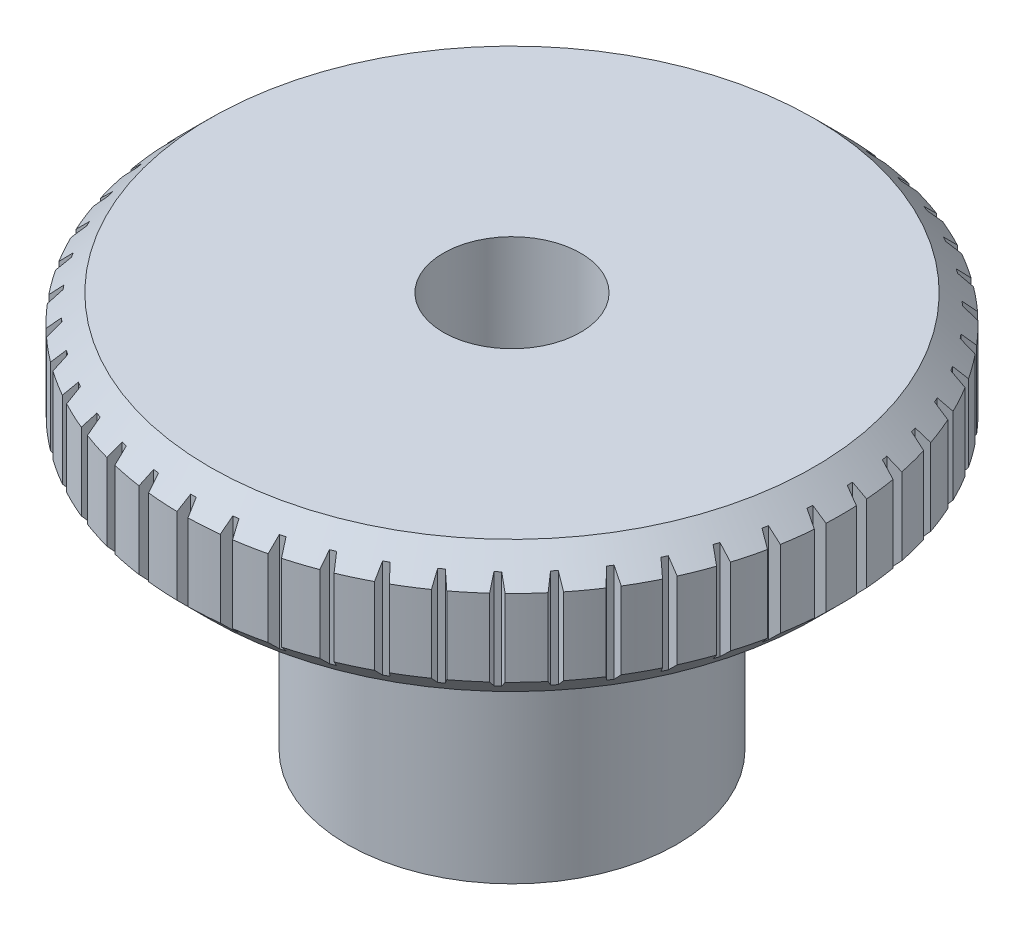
SolidWorks part; units mm, degrees
ref_plane "Спереди" through (0, 0, 0) normal (0, 0, 1) x (1, 0, 0)
ref_plane "Сверху" through (0, 0, 0) normal (0, 1, 0) x (1, 0, 0)
ref_plane "Справа" through (0, 0, 0) normal (1, 0, 0) x (0, 0, -1)
sketch "Эскиз1" plane through (0, 0, 0) normal (0, 0, 1) x (1, 0, 0)
  line L0 (0, 14.4034) -> (0, 0) construction
  line L1 (1.25, 0) -> (1.25, 7.2)
  line L2 (1.25, 7.2) -> (6, 7.2)
  line L3 (6, 7.2) -> (6, 4.8)
  line L4 (6, 4.8) -> (3, 4.8)
  line L5 (3, 4.8) -> (3, 0)
  line L6 (3, 0) -> (1.25, 0)
  dimension "D1" = 2.5
  dimension "D2" = 6
  dimension "D3" = 12
  dimension "D4" = 2.4
  dimension "D5" = 7.2
revolve "Повернуть1" add sketch "Эскиз1" angle 360 about L0
chamfer "Фаска1" distance 0.5 angle 45 2 edges at (0, 7.2, 6) (0, 4.8, 6)
sketch "Эскиз2" plane through (0, 7.2, 0) normal (0, 1, 0) x (1, 0, 0)
  line L0 (0, 9.4009) -> (0, 0) construction
  line L1 (0, 0) -> (11.0968, 0) construction
  line L2 (-0.1, 5.9992) -> (-0.05, 5.8)
  line L3 (-0.05, 5.8) -> (0.05, 5.8)
  line L4 (0.05, 5.8) -> (0.1, 5.9992)
  line L5 (0.7765, 5.748) -> (0.8511, 5.9393)
  line L6 (0.6527, 5.9644) -> (0.6773, 5.7605)
  line L7 (0.6773, 5.7605) -> (0.7765, 5.748)
  line L8 (1.4908, 5.6053) -> (1.5888, 5.7858)
  line L9 (1.3951, 5.8356) -> (1.394, 5.6302)
  line L10 (1.394, 5.6302) -> (1.4908, 5.6053)
  line L11 (2.1816, 5.3743) -> (2.3014, 5.5411)
  line L12 (2.1155, 5.6147) -> (2.0886, 5.4111)
  line L13 (2.0886, 5.4111) -> (2.1816, 5.3743)
  line L14 (2.838, 5.0585) -> (2.9778, 5.2089)
  line L15 (2.8025, 5.3053) -> (2.7504, 5.1067)
  line L16 (2.7504, 5.1067) -> (2.838, 5.0585)
  line L17 (3.4496, 4.6629) -> (3.6071, 4.7946)
  line L18 (3.4453, 4.9122) -> (3.3687, 4.7217)
  line L19 (3.3687, 4.7217) -> (3.4496, 4.6629)
  line L20 (4.0068, 4.1938) -> (4.1796, 4.3047)
  line L21 (4.0338, 4.4417) -> (3.9339, 4.2622)
  line L22 (3.9339, 4.2622) -> (4.0068, 4.1938)
  line L23 (4.5008, 3.6585) -> (4.6862, 3.747)
  line L24 (4.5587, 3.9011) -> (4.4371, 3.7356)
  line L25 (4.4371, 3.7356) -> (4.5008, 3.6585)
  line L26 (4.9239, 3.0656) -> (5.1188, 3.1301)
  line L27 (5.0117, 3.2989) -> (4.8703, 3.15)
  line L28 (4.8703, 3.15) -> (4.9239, 3.0656)
  line L29 (5.2693, 2.4243) -> (5.4708, 2.4638)
  line L30 (5.3856, 2.6448) -> (5.2267, 2.5148)
  line L31 (5.2267, 2.5148) -> (5.2693, 2.4243)
  line L32 (5.5316, 1.7447) -> (5.7364, 1.7587)
  line L33 (5.6746, 1.949) -> (5.5007, 1.8399)
  line L34 (5.5007, 1.8399) -> (5.5316, 1.7447)
  line L35 (5.7066, 1.0377) -> (5.9116, 1.0259)
  line L36 (5.8742, 1.2224) -> (5.6879, 1.1359)
  line L37 (5.6879, 1.1359) -> (5.7066, 1.0377)
  line L38 (5.7917, 0.3143) -> (5.9936, 0.2769)
  line L39 (5.981, 0.4765) -> (5.7854, 0.4141)
  line L40 (5.7854, 0.4141) -> (5.7917, 0.3143)
  line L41 (5.7854, -0.4141) -> (5.981, -0.4765)
  line L42 (5.9936, -0.2769) -> (5.7917, -0.3143)
  line L43 (5.7917, -0.3143) -> (5.7854, -0.4141)
  line L44 (5.6879, -1.1359) -> (5.8742, -1.2224)
  line L45 (5.9116, -1.0259) -> (5.7066, -1.0377)
  line L46 (5.7066, -1.0377) -> (5.6879, -1.1359)
  line L47 (5.5007, -1.8399) -> (5.6746, -1.949)
  line L48 (5.7364, -1.7587) -> (5.5316, -1.7447)
  line L49 (5.5316, -1.7447) -> (5.5007, -1.8399)
  line L50 (5.2267, -2.5148) -> (5.3856, -2.6448)
  line L51 (5.4708, -2.4638) -> (5.2693, -2.4243)
  line L52 (5.2693, -2.4243) -> (5.2267, -2.5148)
  line L53 (4.8703, -3.15) -> (5.0117, -3.2989)
  line L54 (5.1188, -3.1301) -> (4.9239, -3.0656)
  line L55 (4.9239, -3.0656) -> (4.8703, -3.15)
  line L56 (4.4371, -3.7356) -> (4.5587, -3.9011)
  line L57 (4.6862, -3.747) -> (4.5008, -3.6585)
  line L58 (4.5008, -3.6585) -> (4.4371, -3.7356)
  line L59 (3.9339, -4.2622) -> (4.0338, -4.4417)
  line L60 (4.1796, -4.3047) -> (4.0068, -4.1938)
  line L61 (4.0068, -4.1938) -> (3.9339, -4.2622)
  line L62 (3.3687, -4.7217) -> (3.4453, -4.9122)
  line L63 (3.6071, -4.7946) -> (3.4496, -4.6629)
  line L64 (3.4496, -4.6629) -> (3.3687, -4.7217)
  line L65 (2.7504, -5.1067) -> (2.8025, -5.3053)
  line L66 (2.9778, -5.2089) -> (2.838, -5.0585)
  line L67 (2.838, -5.0585) -> (2.7504, -5.1067)
  line L68 (2.0886, -5.4111) -> (2.1155, -5.6147)
  line L69 (2.3014, -5.5411) -> (2.1816, -5.3743)
  line L70 (2.1816, -5.3743) -> (2.0886, -5.4111)
  line L71 (1.394, -5.6302) -> (1.3951, -5.8356)
  line L72 (1.5888, -5.7858) -> (1.4908, -5.6053)
  line L73 (1.4908, -5.6053) -> (1.394, -5.6302)
  line L74 (0.6773, -5.7605) -> (0.6527, -5.9644)
  line L75 (0.8511, -5.9393) -> (0.7765, -5.748)
  line L76 (0.7765, -5.748) -> (0.6773, -5.7605)
  line L77 (-0.05, -5.8) -> (-0.1, -5.9992)
  line L78 (0.1, -5.9992) -> (0.05, -5.8)
  line L79 (0.05, -5.8) -> (-0.05, -5.8)
  line L80 (-0.7765, -5.748) -> (-0.8511, -5.9393)
  line L81 (-0.6527, -5.9644) -> (-0.6773, -5.7605)
  line L82 (-0.6773, -5.7605) -> (-0.7765, -5.748)
  line L83 (-1.4908, -5.6053) -> (-1.5888, -5.7858)
  line L84 (-1.3951, -5.8356) -> (-1.394, -5.6302)
  line L85 (-1.394, -5.6302) -> (-1.4908, -5.6053)
  line L86 (-2.1816, -5.3743) -> (-2.3014, -5.5411)
  line L87 (-2.1155, -5.6147) -> (-2.0886, -5.4111)
  line L88 (-2.0886, -5.4111) -> (-2.1816, -5.3743)
  line L89 (-2.838, -5.0585) -> (-2.9778, -5.2089)
  line L90 (-2.8025, -5.3053) -> (-2.7504, -5.1067)
  line L91 (-2.7504, -5.1067) -> (-2.838, -5.0585)
  line L92 (-3.4496, -4.6629) -> (-3.6071, -4.7946)
  line L93 (-3.4453, -4.9122) -> (-3.3687, -4.7217)
  line L94 (-3.3687, -4.7217) -> (-3.4496, -4.6629)
  line L95 (-4.0068, -4.1938) -> (-4.1796, -4.3047)
  line L96 (-4.0338, -4.4417) -> (-3.9339, -4.2622)
  line L97 (-3.9339, -4.2622) -> (-4.0068, -4.1938)
  line L98 (-4.5008, -3.6585) -> (-4.6862, -3.747)
  line L99 (-4.5587, -3.9011) -> (-4.4371, -3.7356)
  line L100 (-4.4371, -3.7356) -> (-4.5008, -3.6585)
  line L101 (-4.9239, -3.0656) -> (-5.1188, -3.1301)
  line L102 (-5.0117, -3.2989) -> (-4.8703, -3.15)
  line L103 (-4.8703, -3.15) -> (-4.9239, -3.0656)
  line L104 (-5.2693, -2.4243) -> (-5.4708, -2.4638)
  line L105 (-5.3856, -2.6448) -> (-5.2267, -2.5148)
  line L106 (-5.2267, -2.5148) -> (-5.2693, -2.4243)
  line L107 (-5.5316, -1.7447) -> (-5.7364, -1.7587)
  line L108 (-5.6746, -1.949) -> (-5.5007, -1.8399)
  line L109 (-5.5007, -1.8399) -> (-5.5316, -1.7447)
  line L110 (-5.7066, -1.0377) -> (-5.9116, -1.0259)
  line L111 (-5.8742, -1.2224) -> (-5.6879, -1.1359)
  line L112 (-5.6879, -1.1359) -> (-5.7066, -1.0377)
  line L113 (-5.7917, -0.3143) -> (-5.9936, -0.2769)
  line L114 (-5.981, -0.4765) -> (-5.7854, -0.4141)
  line L115 (-5.7854, -0.4141) -> (-5.7917, -0.3143)
  line L116 (-5.7854, 0.4141) -> (-5.981, 0.4765)
  line L117 (-5.9936, 0.2769) -> (-5.7917, 0.3143)
  line L118 (-5.7917, 0.3143) -> (-5.7854, 0.4141)
  line L119 (-5.6879, 1.1359) -> (-5.8742, 1.2224)
  line L120 (-5.9116, 1.0259) -> (-5.7066, 1.0377)
  line L121 (-5.7066, 1.0377) -> (-5.6879, 1.1359)
  line L122 (-5.5007, 1.8399) -> (-5.6746, 1.949)
  line L123 (-5.7364, 1.7587) -> (-5.5316, 1.7447)
  line L124 (-5.5316, 1.7447) -> (-5.5007, 1.8399)
  line L125 (-5.2267, 2.5148) -> (-5.3856, 2.6448)
  line L126 (-5.4708, 2.4638) -> (-5.2693, 2.4243)
  line L127 (-5.2693, 2.4243) -> (-5.2267, 2.5148)
  line L128 (-4.8703, 3.15) -> (-5.0117, 3.2989)
  line L129 (-5.1188, 3.1301) -> (-4.9239, 3.0656)
  line L130 (-4.9239, 3.0656) -> (-4.8703, 3.15)
  line L131 (-4.4371, 3.7356) -> (-4.5587, 3.9011)
  line L132 (-4.6862, 3.747) -> (-4.5008, 3.6585)
  line L133 (-4.5008, 3.6585) -> (-4.4371, 3.7356)
  line L134 (-3.9339, 4.2622) -> (-4.0338, 4.4417)
  line L135 (-4.1796, 4.3047) -> (-4.0068, 4.1938)
  line L136 (-4.0068, 4.1938) -> (-3.9339, 4.2622)
  line L137 (-3.3687, 4.7217) -> (-3.4453, 4.9122)
  line L138 (-3.6071, 4.7946) -> (-3.4496, 4.6629)
  line L139 (-3.4496, 4.6629) -> (-3.3687, 4.7217)
  line L140 (-2.7504, 5.1067) -> (-2.8025, 5.3053)
  line L141 (-2.9778, 5.2089) -> (-2.838, 5.0585)
  line L142 (-2.838, 5.0585) -> (-2.7504, 5.1067)
  line L143 (-2.0886, 5.4111) -> (-2.1155, 5.6147)
  line L144 (-2.3014, 5.5411) -> (-2.1816, 5.3743)
  line L145 (-2.1816, 5.3743) -> (-2.0886, 5.4111)
  line L146 (-1.394, 5.6302) -> (-1.3951, 5.8356)
  line L147 (-1.5888, 5.7858) -> (-1.4908, 5.6053)
  line L148 (-1.4908, 5.6053) -> (-1.394, 5.6302)
  line L149 (-0.6773, 5.7605) -> (-0.6527, 5.9644)
  line L150 (-0.8511, 5.9393) -> (-0.7765, 5.748)
  line L151 (-0.7765, 5.748) -> (-0.6773, 5.7605)
  circle A0 centre (0, 0) radius 6 construction
  arc A1 (0.1, 5.9992) -> (-0.1, 5.9992) centre (0, 0) ccw
  arc A2 (0.8511, 5.9393) -> (0.6527, 5.9644) centre (0, 0) ccw
  arc A3 (1.5888, 5.7858) -> (1.3951, 5.8356) centre (0, 0) ccw
  arc A4 (2.3014, 5.5411) -> (2.1155, 5.6147) centre (0, 0) ccw
  arc A5 (2.9778, 5.2089) -> (2.8025, 5.3053) centre (0, 0) ccw
  arc A6 (3.6071, 4.7946) -> (3.4453, 4.9122) centre (0, 0) ccw
  arc A7 (4.1796, 4.3047) -> (4.0338, 4.4417) centre (0, 0) ccw
  arc A8 (4.6862, 3.747) -> (4.5587, 3.9011) centre (0, 0) ccw
  arc A9 (5.1188, 3.1301) -> (5.0117, 3.2989) centre (0, 0) ccw
  arc A10 (5.4708, 2.4638) -> (5.3856, 2.6448) centre (0, 0) ccw
  arc A11 (5.7364, 1.7587) -> (5.6746, 1.949) centre (0, 0) ccw
  arc A12 (5.9116, 1.0259) -> (5.8742, 1.2224) centre (0, 0) ccw
  arc A13 (5.9936, 0.2769) -> (5.981, 0.4765) centre (0, 0) ccw
  arc A14 (5.981, -0.4765) -> (5.9936, -0.2769) centre (0, 0) ccw
  arc A15 (5.8742, -1.2224) -> (5.9116, -1.0259) centre (0, 0) ccw
  arc A16 (5.6746, -1.949) -> (5.7364, -1.7587) centre (0, 0) ccw
  arc A17 (5.3856, -2.6448) -> (5.4708, -2.4638) centre (0, 0) ccw
  arc A18 (5.0117, -3.2989) -> (5.1188, -3.1301) centre (0, 0) ccw
  arc A19 (4.5587, -3.9011) -> (4.6862, -3.747) centre (0, 0) ccw
  arc A20 (4.0338, -4.4417) -> (4.1796, -4.3047) centre (0, 0) ccw
  arc A21 (3.4453, -4.9122) -> (3.6071, -4.7946) centre (0, 0) ccw
  arc A22 (2.8025, -5.3053) -> (2.9778, -5.2089) centre (0, 0) ccw
  arc A23 (2.1155, -5.6147) -> (2.3014, -5.5411) centre (0, 0) ccw
  arc A24 (1.3951, -5.8356) -> (1.5888, -5.7858) centre (0, 0) ccw
  arc A25 (0.6527, -5.9644) -> (0.8511, -5.9393) centre (0, 0) ccw
  arc A26 (-0.1, -5.9992) -> (0.1, -5.9992) centre (0, 0) ccw
  arc A27 (-0.8511, -5.9393) -> (-0.6527, -5.9644) centre (0, 0) ccw
  arc A28 (-1.5888, -5.7858) -> (-1.3951, -5.8356) centre (0, 0) ccw
  arc A29 (-2.3014, -5.5411) -> (-2.1155, -5.6147) centre (0, 0) ccw
  arc A30 (-2.9778, -5.2089) -> (-2.8025, -5.3053) centre (0, 0) ccw
  arc A31 (-3.6071, -4.7946) -> (-3.4453, -4.9122) centre (0, 0) ccw
  arc A32 (-4.1796, -4.3047) -> (-4.0338, -4.4417) centre (0, 0) ccw
  arc A33 (-4.6862, -3.747) -> (-4.5587, -3.9011) centre (0, 0) ccw
  arc A34 (-5.1188, -3.1301) -> (-5.0117, -3.2989) centre (0, 0) ccw
  arc A35 (-5.4708, -2.4638) -> (-5.3856, -2.6448) centre (0, 0) ccw
  arc A36 (-5.7364, -1.7587) -> (-5.6746, -1.949) centre (0, 0) ccw
  arc A37 (-5.9116, -1.0259) -> (-5.8742, -1.2224) centre (0, 0) ccw
  arc A38 (-5.9936, -0.2769) -> (-5.981, -0.4765) centre (0, 0) ccw
  arc A39 (-5.981, 0.4765) -> (-5.9936, 0.2769) centre (0, 0) ccw
  arc A40 (-5.8742, 1.2224) -> (-5.9116, 1.0259) centre (0, 0) ccw
  arc A41 (-5.6746, 1.949) -> (-5.7364, 1.7587) centre (0, 0) ccw
  arc A42 (-5.3856, 2.6448) -> (-5.4708, 2.4638) centre (0, 0) ccw
  arc A43 (-5.0117, 3.2989) -> (-5.1188, 3.1301) centre (0, 0) ccw
  arc A44 (-4.5587, 3.9011) -> (-4.6862, 3.747) centre (0, 0) ccw
  arc A45 (-4.0338, 4.4417) -> (-4.1796, 4.3047) centre (0, 0) ccw
  arc A46 (-3.4453, 4.9122) -> (-3.6071, 4.7946) centre (0, 0) ccw
  arc A47 (-2.8025, 5.3053) -> (-2.9778, 5.2089) centre (0, 0) ccw
  arc A48 (-2.1155, 5.6147) -> (-2.3014, 5.5411) centre (0, 0) ccw
  arc A49 (-1.3951, 5.8356) -> (-1.5888, 5.7858) centre (0, 0) ccw
  arc A50 (-0.6527, 5.9644) -> (-0.8511, 5.9393) centre (0, 0) ccw
  point P8 (0, 5.8)
  point P209 (0, 0)
  dimension "D1" = 0.1
  dimension "D2" = 5.8
  dimension "D3" = 0.2
  dimension "D4" = 50
extrude "Вырез-Вытянуть1" cut sketch "Эскиз2" against normal through all
